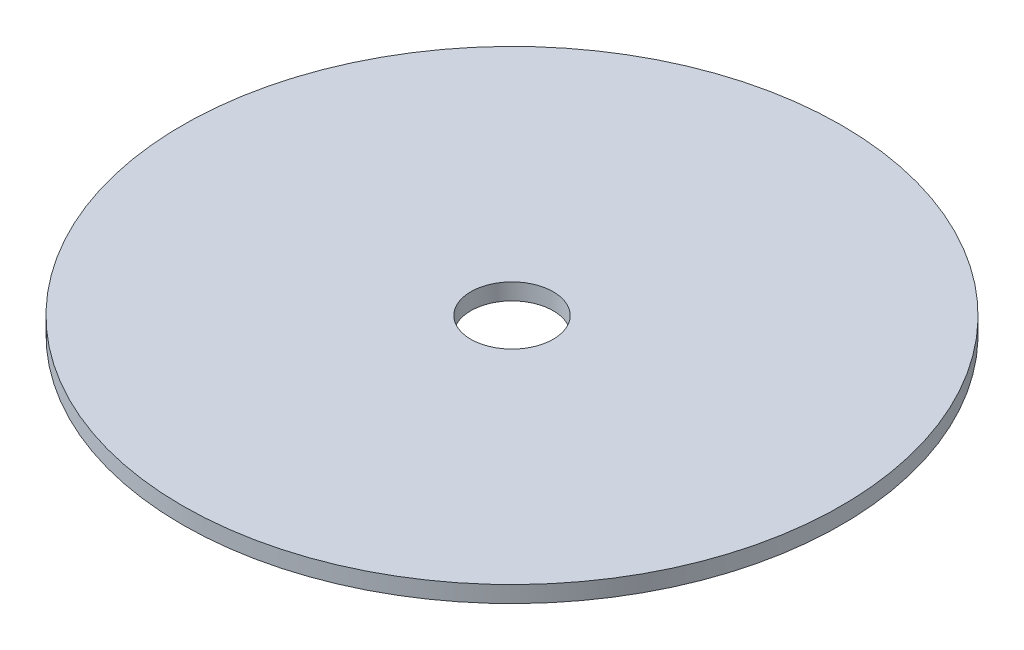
SolidWorks part; units mm, degrees
ref_plane "Ebene vorne" through (0, 0, 0) normal (0, 0, 1) x (1, 0, 0)
ref_plane "Ebene oben" through (0, 0, 0) normal (0, 1, 0) x (1, 0, 0)
ref_plane "Ebene rechts" through (0, 0, 0) normal (1, 0, 0) x (0, 0, -1)
sketch "Skizze1" plane through (0, 0, 0) normal (0, 1, 0) x (1, 0, 0)
  circle A0 centre (0, 0) radius 40
  circle A1 centre (0, 0) radius 5
  dimension "D1" = 10
  dimension "D2" = 80
extrude "Aufsatz-Linear austragen1" add sketch "Skizze1" along normal blind 2
